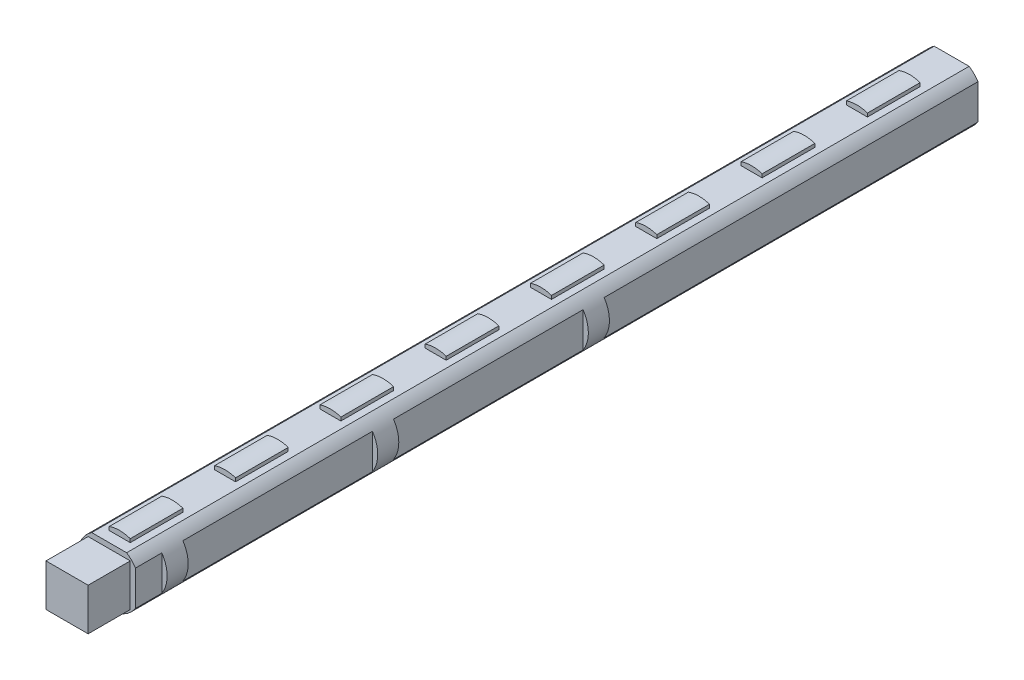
SolidWorks part; units mm, degrees
ref_plane "Front Plane" through (0, 0, 0) normal (0, 0, 1) x (1, 0, 0)
ref_plane "Top Plane" through (0, 0, 0) normal (0, 1, 0) x (1, 0, 0)
ref_plane "Right Plane" through (0, 0, 0) normal (1, 0, 0) x (0, 0, -1)
sketch "Sketch1" plane through (0, 0, 0) normal (0, 0, 1) x (1, 0, 0)
  circle A0 centre (-19.05, -19.05) radius 19.05
  dimension "D1" = 38.1
  dimension "D2" = 19.05
  dimension "D3" = 19.05
extrude "Extrude1" add sketch "Sketch1" along normal blind 508
sketch "Sketch2" plane through (0, 0, 0) normal (0, 1, 0) x (1, 0, 0)
  line L0 (-38.1, 0) -> (-38.1, -508) construction
  line L1 (-25.4, -25.4) -> (-12.7, -25.4)
  line L2 (-25.4, -25.4) -> (-25.4, -57.15)
  line L3 (-25.4, -57.15) -> (-12.7, -57.15)
  line L4 (-12.7, -25.4) -> (-12.7, -57.15)
  line L5 (-25.4, -88.9) -> (-12.7, -88.9)
  line L6 (-38.1, 0) -> (0, 0)
  line L7 (-38.1, 0) -> (-38.1, -508)
  line L8 (-38.1, -508) -> (0, -508)
  line L9 (0, 0) -> (0, -508)
  line L10 (-25.4, -88.9) -> (-25.4, -120.65)
  line L11 (-25.4, -120.65) -> (-12.7, -120.65)
  line L12 (-12.7, -88.9) -> (-12.7, -120.65)
  line L13 (-25.4, -152.4) -> (-12.7, -152.4)
  line L14 (-25.4, -152.4) -> (-25.4, -184.15)
  line L15 (-25.4, -184.15) -> (-12.7, -184.15)
  line L16 (-12.7, -152.4) -> (-12.7, -184.15)
  line L17 (-25.4, -215.9) -> (-12.7, -215.9)
  line L18 (-25.4, -215.9) -> (-25.4, -247.65)
  line L19 (-25.4, -247.65) -> (-12.7, -247.65)
  line L20 (-12.7, -215.9) -> (-12.7, -247.65)
  line L21 (-25.4, -279.4) -> (-12.7, -279.4)
  line L22 (-25.4, -279.4) -> (-25.4, -311.15)
  line L23 (-25.4, -311.15) -> (-12.7, -311.15)
  line L24 (-12.7, -279.4) -> (-12.7, -311.15)
  line L25 (-25.4, -342.9) -> (-12.7, -342.9)
  line L26 (-25.4, -342.9) -> (-25.4, -374.65)
  line L27 (-25.4, -374.65) -> (-12.7, -374.65)
  line L28 (-12.7, -342.9) -> (-12.7, -374.65)
  line L29 (-25.4, -406.4) -> (-12.7, -406.4)
  line L30 (-25.4, -406.4) -> (-25.4, -438.15)
  line L31 (-25.4, -438.15) -> (-12.7, -438.15)
  line L32 (-12.7, -406.4) -> (-12.7, -438.15)
  line L33 (-25.4, -469.9) -> (-12.7, -469.9)
  line L34 (-25.4, -469.9) -> (-25.4, -501.65)
  line L35 (-25.4, -501.65) -> (-12.7, -501.65)
  line L36 (-12.7, -469.9) -> (-12.7, -501.65)
  dimension "D1" = 12.7
  dimension "D2" = 31.75
  dimension "D3" = 12.7
  dimension "D4" = 25.4
extrude "Cut-Extrude1" cut sketch "Sketch2" against normal blind 3.175
sketch "Sketch3" plane through (0, 0, 0) normal (1, 0, 0) x (0, 0, -1)
  line L0 (-508, -38.1) -> (0, -38.1) construction
  line L1 (-238.125, -3.175) -> (-225.425, -3.175)
  line L2 (-238.125, -3.175) -> (-238.125, -34.925)
  line L3 (-238.125, -34.925) -> (-225.425, -34.925)
  line L4 (-225.425, -3.175) -> (-225.425, -34.925)
  line L5 (-215.9, -3.175) -> (-215.9, -1.0895) construction
  line L7 (-365.125, -3.175) -> (-352.425, -3.175)
  line L8 (-508, -38.1) -> (0, -38.1)
  line L9 (-508, -38.1) -> (-508, 0)
  line L10 (-508, 0) -> (0, 0)
  line L11 (0, -38.1) -> (0, 0)
  line L12 (-365.125, -3.175) -> (-365.125, -34.925)
  line L13 (-365.125, -34.925) -> (-352.425, -34.925)
  line L14 (-352.425, -3.175) -> (-352.425, -34.925)
  line L15 (-492.125, -3.175) -> (-479.425, -3.175)
  line L16 (-492.125, -3.175) -> (-492.125, -34.925)
  line L17 (-492.125, -34.925) -> (-479.425, -34.925)
  line L18 (-479.425, -3.175) -> (-479.425, -34.925)
  line L19 (-238.125, -3.175) -> (-365.125, -3.175) construction
  dimension "D1" = 31.75
  dimension "D2" = 3.175
  dimension "D3" = 12.7
  dimension "D4" = 9.525
  dimension "D5" = 127
extrude "Cut-Extrude2" cut sketch "Sketch3" against normal blind 3.175
sketch "Sketch6" plane through (0, 0, 0) normal (0, 0, -1) x (-1, 0, 0)
  circle A0 centre (19.05, -19.05) radius 6.35
  dimension "D1" = 12.7
extrude "Cut-Extrude3" cut sketch "Sketch6" against normal blind 50.8
sketch "Sketch7" plane through (0, 0, 508) normal (0, 0, 1) x (1, 0, 0)
  line L0 (-38.1, -19.05) -> (0, -19.05) construction
  line L1 (-31.75, -6.35) -> (-6.35, -6.35)
  line L2 (-31.75, -6.35) -> (-31.75, -31.75)
  line L3 (-31.75, -31.75) -> (-6.35, -31.75)
  line L4 (-6.35, -6.35) -> (-6.35, -31.75)
  line L5 (0, -19.05) -> (-19.05, 0) construction
  line L6 (-19.05, 0) -> (-19.05, -38.1) construction
  arc A0 (-29.5803, -3.175) -> (-3.175, -29.5803) centre (-19.05, -19.05) ccw construction
  arc A1 (-3.175, -29.5803) -> (-3.175, -8.5197) centre (-19.05, -19.05) ccw construction
  arc A2 (-12.7, -1.0895) -> (-25.4, -1.0895) centre (-19.05, -19.05) ccw construction
  dimension "D1" = 25.4
  dimension "D2" = 25.4
  dimension "D3" = 12.7
  dimension "D4" = 12.7
extrude "Extrude2" add sketch "Sketch7" along normal blind 25.4
